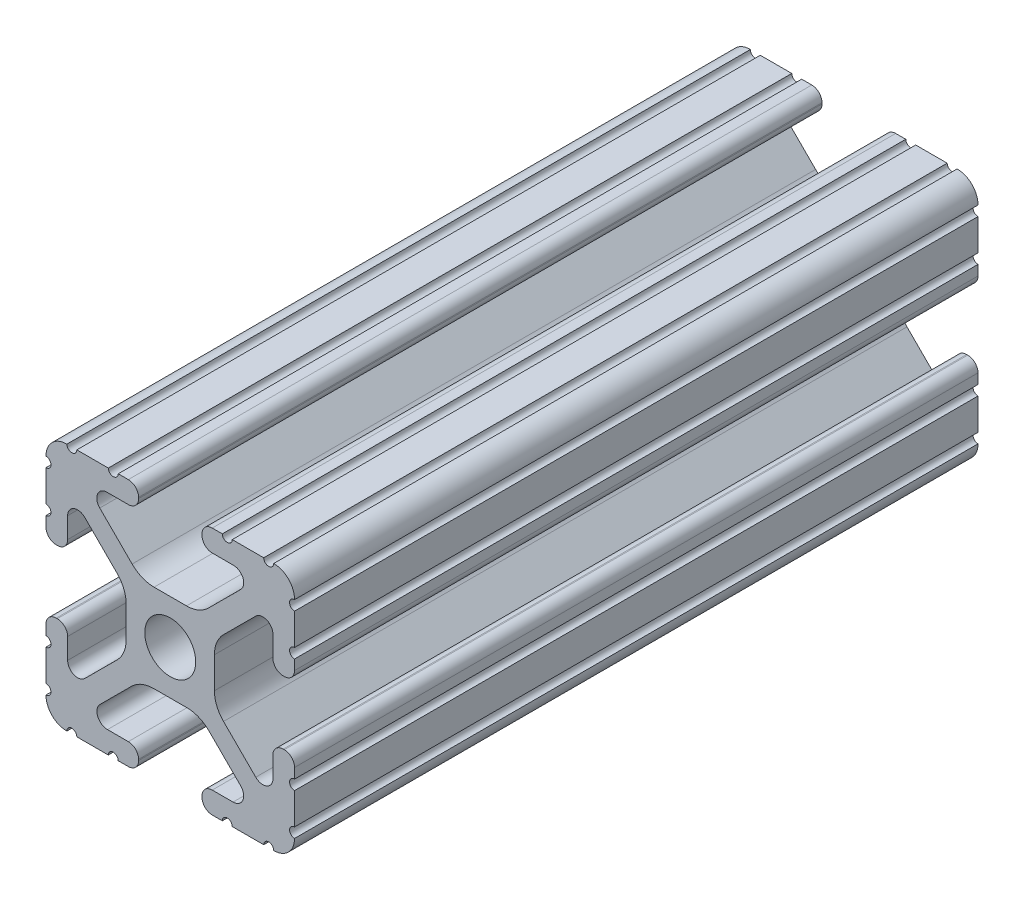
SolidWorks part; units mm, degrees
ref_plane "Front" through (0, 0, 0) normal (0, 0, 1) x (1, 0, 0)
ref_plane "Top" through (0, 0, 0) normal (0, 1, 0) x (1, 0, 0)
ref_plane "Right" through (0, 0, 0) normal (1, 0, 0) x (0, 0, -1)
sketch "Sketch1" plane through (0, 0, 0) normal (0, 0, 1) x (1, 0, 0)
  line L0 (-7.5107, 9.4563) -> (7.5107, 9.4563) construction
  line L1 (-7.4968, -9.4098) -> (7.4968, -9.4098) construction
  line L88 (-7.1797, -8.6452) -> (-3.9523, -5.4237)
  line L89 (-1.7093, -4.4958) -> (1.7093, -4.4958)
  line L90 (3.9523, -5.4237) -> (7.1797, -8.6452)
  line L91 (6.4164, -10.4902) -> (4.2875, -10.4902)
  line L92 (3.2385, -11.5392) -> (3.2385, -11.651)
  line L93 (4.2875, -12.7) -> (5.3171, -12.7)
  line L94 (6.3331, -12.7) -> (9.5504, -12.7)
  line L95 (12.7, -9.5504) -> (12.7, -6.3331)
  line L96 (12.7, -5.3171) -> (12.7, -4.2875)
  line L97 (11.651, -3.2385) -> (11.5392, -3.2385)
  line L98 (10.4902, -4.2875) -> (10.4902, -6.4021)
  line L99 (8.7371, -7.1294) -> (5.441, -3.8408)
  line L100 (4.5085, -1.5932) -> (4.5085, 1.5932)
  line L101 (5.441, 3.8408) -> (8.7371, 7.1294)
  line L102 (10.4902, 6.4021) -> (10.4902, 4.2875)
  line L103 (11.5392, 3.2385) -> (11.651, 3.2385)
  line L104 (12.7, 4.2875) -> (12.7, 5.3171)
  line L105 (12.7, 6.3331) -> (12.7, 9.5504)
  line L106 (9.5504, 12.7) -> (6.3331, 12.7)
  line L107 (5.3171, 12.7) -> (4.2875, 12.7)
  line L108 (3.2385, 11.651) -> (3.2385, 11.5392)
  line L109 (4.2875, 10.4902) -> (6.4768, 10.4902)
  line L110 (7.207, 8.7244) -> (3.8983, 5.4232)
  line L111 (1.6558, 4.4958) -> (-1.6558, 4.4958)
  line L112 (-3.8983, 5.4232) -> (-7.207, 8.7244)
  line L113 (-6.4768, 10.4902) -> (-4.2875, 10.4902)
  line L114 (-3.2385, 11.5392) -> (-3.2385, 11.651)
  line L115 (-4.2875, 12.7) -> (-5.3171, 12.7)
  line L116 (-6.3331, 12.7) -> (-9.5504, 12.7)
  line L117 (-12.7, 9.5504) -> (-12.7, 6.3331)
  line L118 (-12.7, 5.3171) -> (-12.7, 4.2875)
  line L119 (-11.651, 3.2385) -> (-11.5392, 3.2385)
  line L120 (-10.4902, 4.2875) -> (-10.4902, 6.4021)
  line L121 (-8.7371, 7.1294) -> (-5.441, 3.8408)
  line L122 (-4.5085, 1.5932) -> (-4.5085, -1.5932)
  line L123 (-5.441, -3.8408) -> (-8.7371, -7.1294)
  line L124 (-10.4902, -6.4021) -> (-10.4902, -4.2875)
  line L125 (-11.5392, -3.2385) -> (-11.651, -3.2385)
  line L126 (-12.7, -4.2875) -> (-12.7, -5.3171)
  line L127 (-12.7, -6.3331) -> (-12.7, -9.5504)
  line L128 (-9.5504, -12.7) -> (-6.3331, -12.7)
  line L129 (-5.3171, -12.7) -> (-4.2875, -12.7)
  line L130 (-3.2385, -11.651) -> (-3.2385, -11.5392)
  line L131 (-4.2875, -10.4902) -> (-6.4164, -10.4902)
  circle A1 centre (0, 0) radius 2.6035
  arc A104 (-7.1797, -8.6452) -> (-6.4164, -10.4902) centre (-6.4164, -9.4098) ccw
  arc A105 (-1.7093, -4.4958) -> (-3.9523, -5.4237) centre (-1.7093, -7.6708) ccw
  arc A106 (3.9523, -5.4237) -> (1.7093, -4.4958) centre (1.7093, -7.6708) ccw
  arc A107 (6.4164, -10.4902) -> (7.1797, -8.6452) centre (6.4164, -9.4098) ccw
  arc A108 (4.2875, -10.4902) -> (3.2385, -11.5392) centre (4.2875, -11.5392) ccw
  arc A109 (3.2385, -11.651) -> (4.2875, -12.7) centre (4.2875, -11.651) ccw
  arc A110 (6.3331, -12.7) -> (5.3171, -12.7) centre (5.8251, -12.7) ccw
  arc A111 (10.5664, -12.6998) -> (9.5504, -12.7) centre (10.0584, -12.7) ccw
  arc A112 (10.5664, -12.6998) -> (12.6998, -10.5664) centre (10.5918, -10.5918) ccw
  arc A113 (12.7, -9.5504) -> (12.6998, -10.5664) centre (12.7, -10.0584) ccw
  arc A114 (12.7, -5.3171) -> (12.7, -6.3331) centre (12.7, -5.8251) ccw
  arc A115 (12.7, -4.2875) -> (11.651, -3.2385) centre (11.651, -4.2875) ccw
  arc A116 (11.5392, -3.2385) -> (10.4902, -4.2875) centre (11.5392, -4.2875) ccw
  arc A117 (8.7371, -7.1294) -> (10.4902, -6.4021) centre (9.4628, -6.4021) ccw
  arc A118 (4.5085, -1.5932) -> (5.441, -3.8408) centre (7.6835, -1.5932) ccw
  arc A119 (5.441, 3.8408) -> (4.5085, 1.5932) centre (7.6835, 1.5932) ccw
  arc A120 (10.4902, 6.4021) -> (8.7371, 7.1294) centre (9.4628, 6.4021) ccw
  arc A121 (10.4902, 4.2875) -> (11.5392, 3.2385) centre (11.5392, 4.2875) ccw
  arc A122 (11.651, 3.2385) -> (12.7, 4.2875) centre (11.651, 4.2875) ccw
  arc A123 (12.7, 6.3331) -> (12.7, 5.3171) centre (12.7, 5.8251) ccw
  arc A124 (12.6998, 10.5664) -> (12.7, 9.5504) centre (12.7, 10.0584) ccw
  arc A125 (12.6998, 10.5664) -> (10.5664, 12.6998) centre (10.5918, 10.5918) ccw
  arc A126 (9.5504, 12.7) -> (10.5664, 12.6998) centre (10.0584, 12.7) ccw
  arc A127 (5.3171, 12.7) -> (6.3331, 12.7) centre (5.8251, 12.7) ccw
  arc A128 (4.2875, 12.7) -> (3.2385, 11.651) centre (4.2875, 11.651) ccw
  arc A129 (3.2385, 11.5392) -> (4.2875, 10.4902) centre (4.2875, 11.5392) ccw
  arc A130 (7.207, 8.7244) -> (6.4768, 10.4902) centre (6.4768, 9.4563) ccw
  arc A131 (1.6558, 4.4958) -> (3.8983, 5.4232) centre (1.6558, 7.6708) ccw
  arc A132 (-3.8983, 5.4232) -> (-1.6558, 4.4958) centre (-1.6558, 7.6708) ccw
  arc A133 (-6.4768, 10.4902) -> (-7.207, 8.7244) centre (-6.4768, 9.4563) ccw
  arc A134 (-4.2875, 10.4902) -> (-3.2385, 11.5392) centre (-4.2875, 11.5392) ccw
  arc A135 (-3.2385, 11.651) -> (-4.2875, 12.7) centre (-4.2875, 11.651) ccw
  arc A136 (-6.3331, 12.7) -> (-5.3171, 12.7) centre (-5.8251, 12.7) ccw
  arc A137 (-10.5664, 12.6998) -> (-9.5504, 12.7) centre (-10.0584, 12.7) ccw
  arc A138 (-10.5664, 12.6998) -> (-12.6998, 10.5664) centre (-10.5918, 10.5918) ccw
  arc A139 (-12.7, 9.5504) -> (-12.6998, 10.5664) centre (-12.7, 10.0584) ccw
  arc A140 (-12.7, 5.3171) -> (-12.7, 6.3331) centre (-12.7, 5.8251) ccw
  arc A141 (-12.7, 4.2875) -> (-11.651, 3.2385) centre (-11.651, 4.2875) ccw
  arc A142 (-11.5392, 3.2385) -> (-10.4902, 4.2875) centre (-11.5392, 4.2875) ccw
  arc A143 (-8.7371, 7.1294) -> (-10.4902, 6.4021) centre (-9.4628, 6.4021) ccw
  arc A144 (-4.5085, 1.5932) -> (-5.441, 3.8408) centre (-7.6835, 1.5932) ccw
  arc A145 (-5.441, -3.8408) -> (-4.5085, -1.5932) centre (-7.6835, -1.5932) ccw
  arc A146 (-10.4902, -6.4021) -> (-8.7371, -7.1294) centre (-9.4628, -6.4021) ccw
  arc A147 (-10.4902, -4.2875) -> (-11.5392, -3.2385) centre (-11.5392, -4.2875) ccw
  arc A148 (-11.651, -3.2385) -> (-12.7, -4.2875) centre (-11.651, -4.2875) ccw
  arc A149 (-12.7, -6.3331) -> (-12.7, -5.3171) centre (-12.7, -5.8251) ccw
  arc A150 (-12.6998, -10.5664) -> (-12.7, -9.5504) centre (-12.7, -10.0584) ccw
  arc A151 (-12.6998, -10.5664) -> (-10.5664, -12.6998) centre (-10.5918, -10.5918) ccw
  arc A152 (-9.5504, -12.7) -> (-10.5664, -12.6998) centre (-10.0584, -12.7) ccw
  arc A153 (-5.3171, -12.7) -> (-6.3331, -12.7) centre (-5.8251, -12.7) ccw
  arc A154 (-4.2875, -12.7) -> (-3.2385, -11.651) centre (-4.2875, -11.651) ccw
  arc A155 (-3.2385, -11.5392) -> (-4.2875, -10.4902) centre (-4.2875, -11.5392) ccw
extrude "Boss-Extrude1" add sketch "Sketch1" along normal mid plane 69.85
